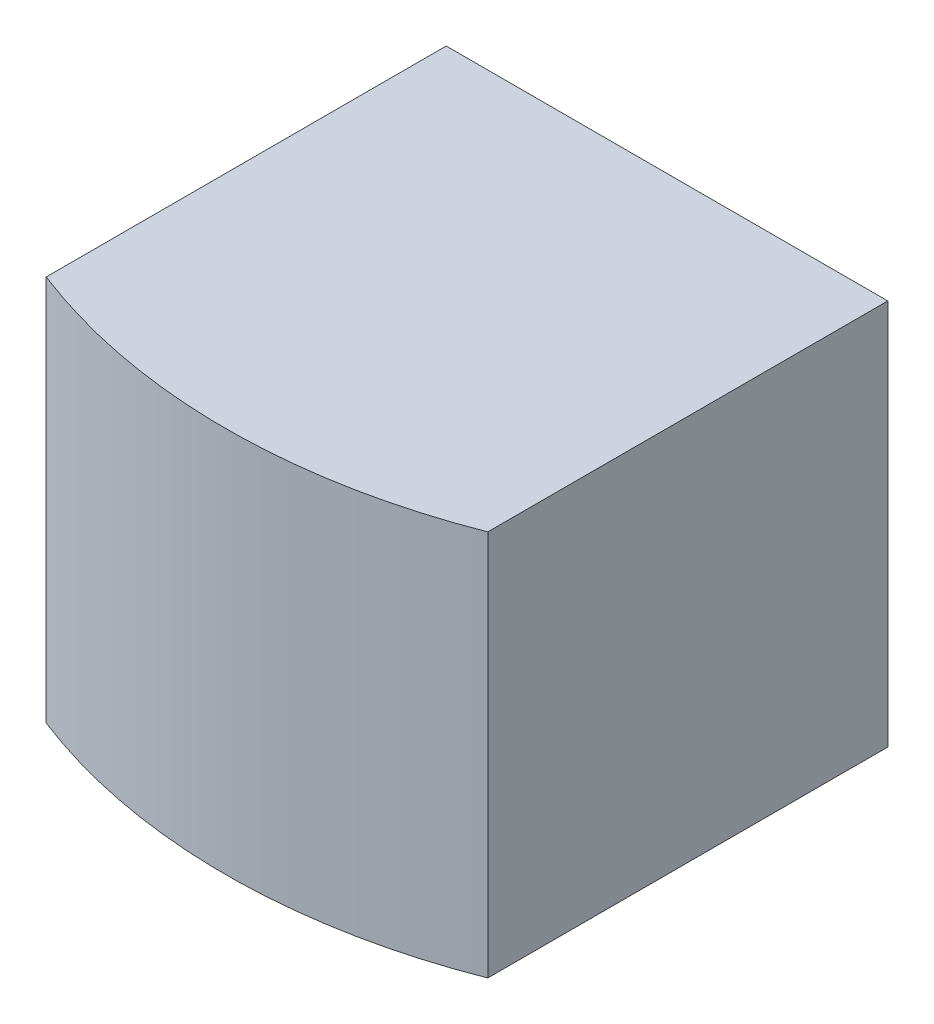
SolidWorks part; units mm, degrees
ref_plane "Front Plane" through (0, 0, 0) normal (0, 0, 1) x (1, 0, 0)
ref_plane "Top Plane" through (0, 0, 0) normal (0, 1, 0) x (1, 0, 0)
ref_plane "Right Plane" through (0, 0, 0) normal (1, 0, 0) x (0, 0, -1)
sketch "Sketch1" plane through (0, 0, 0) normal (0, 0, 1) x (1, 0, 0)
  line L0 (0, 0) -> (0, 88.9688) construction
  line L1 (-12.7, 0) -> (-132.7199, 0) construction
  line L2 (-12.7, 2.54) -> (-12.7, 78.74)
  line L3 (-38.1, 91.44) -> (-139.7, 91.44)
  line L4 (0, 0) -> (-12.7, 0) construction
  line L5 (-12.7, 2.54) -> (-139.7, 2.54)
  line L6 (-139.7, 2.54) -> (-139.7, 91.44)
  line L7 (-38.1, 91.44) -> (-25.4, 78.74)
  line L8 (-25.4, 78.74) -> (-12.7, 78.74)
  dimension "D1" = 88.9
  dimension "D2" = 76.2
  dimension "D3" = 25.4
  dimension "D4" = 2.54
  dimension "D5" = 279.4
  dimension "D6" = 12.7
  dimension "D7" = 135
revolve "Revolve1" add sketch "Sketch1" angle 360 about L0
sketch "Sketch2" plane through (0, 91.44, 0) normal (0, -1, 0) x (1, 0, 0)
  line L0 (0, 0) -> (0, 50.8) construction
  line L2 (50.8, 50.8) -> (50.8, 138.4479)
  line L3 (-50.8, 138.4479) -> (-50.8, 38.1)
  line L4 (-50.8, 38.1) -> (50.8, 38.1)
  line L6 (50.8, 38.1) -> (50.8, 50.8)
  arc A0 (-50.8, 138.4479) -> (50.8, 138.4479) centre (0, 0) ccw
  dimension "D1" = 50.8
  dimension "D2" = 50.8
  dimension "D4" = 38.1
  dimension "D5" = 50.8
extrude "Cut-Extrude1" cut sketch "Sketch2" along normal through all
